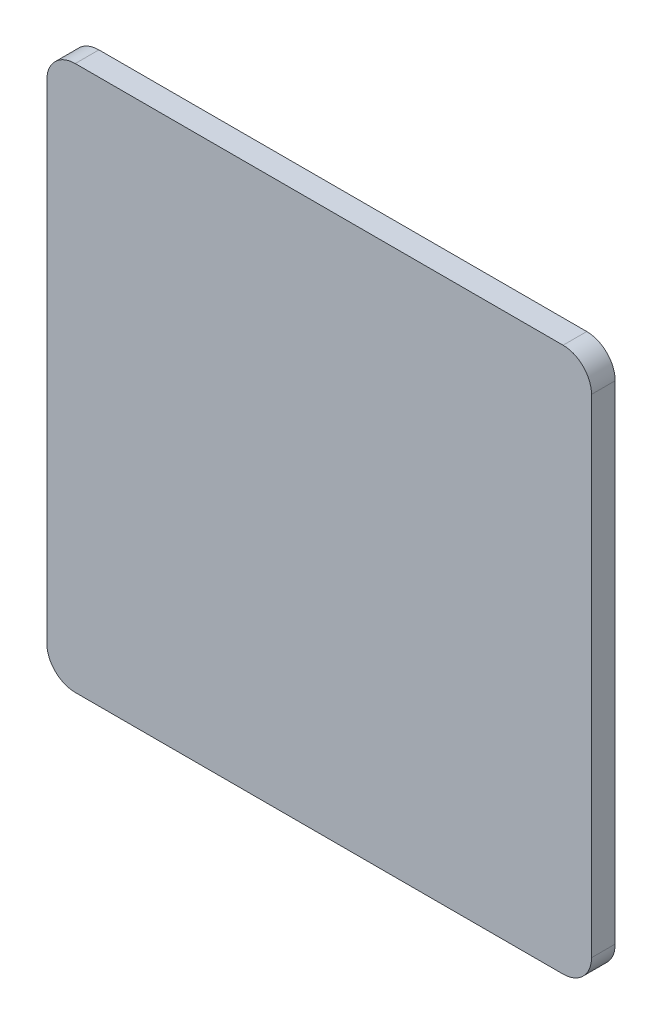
SolidWorks part; units mm, degrees
ref_plane "Front Plane" through (0, 0, 0) normal (0, 0, 1) x (1, 0, 0)
ref_plane "Top Plane" through (0, 0, 0) normal (0, 1, 0) x (1, 0, 0)
ref_plane "Right Plane" through (0, 0, 0) normal (1, 0, 0) x (0, 0, -1)
sketch "Sketch1" plane through (0, 0, 0) normal (0, 0, 1) x (1, 0, 0)
  line L4 (65.405, 73.025) -> (-65.405, 73.025)
  line L5 (-73.025, 65.405) -> (-73.025, -65.405)
  line L6 (-65.405, -73.025) -> (65.405, -73.025)
  line L7 (73.025, -65.405) -> (73.025, 65.405)
  line L8 (65.405, 73.025) -> (-65.405, 73.025)
  line L9 (-73.025, 65.405) -> (-73.025, -65.405)
  line L10 (-65.405, -73.025) -> (65.405, -73.025)
  line L11 (73.025, -65.405) -> (73.025, 65.405)
  arc A4 (-65.405, 73.025) -> (-73.025, 65.405) centre (-65.405, 65.405) ccw
  arc A5 (-73.025, -65.405) -> (-65.405, -73.025) centre (-65.405, -65.405) ccw
  arc A6 (65.405, -73.025) -> (73.025, -65.405) centre (65.405, -65.405) ccw
  arc A7 (73.025, 65.405) -> (65.405, 73.025) centre (65.405, 65.405) ccw
  arc A8 (-65.405, 73.025) -> (-73.025, 65.405) centre (-65.405, 65.405) ccw
  arc A9 (-73.025, -65.405) -> (-65.405, -73.025) centre (-65.405, -65.405) ccw
  arc A10 (65.405, -73.025) -> (73.025, -65.405) centre (65.405, -65.405) ccw
  arc A11 (73.025, 65.405) -> (65.405, 73.025) centre (65.405, 65.405) ccw
  dimension "D1" = 0
extrude "Extrude1" add sketch "Sketch1" along normal up to surface (6.35 mm away)
